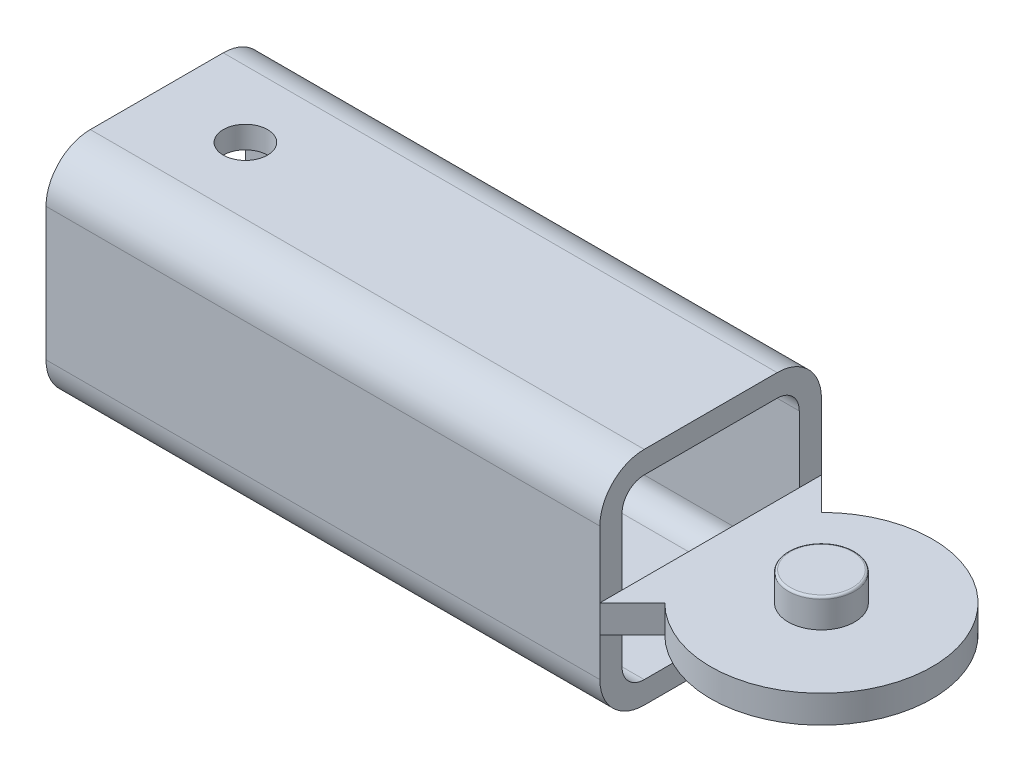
SolidWorks part; units mm, degrees
ref_plane "Front Plane" through (0, 0, 0) normal (0, 0, 1) x (1, 0, 0)
ref_plane "Top Plane" through (0, 0, 0) normal (0, 1, 0) x (1, 0, 0)
ref_plane "Right Plane" through (0, 0, 0) normal (1, 0, 0) x (0, 0, -1)
sketch "Sketch1" plane through (0, 0, 0) normal (0, 1, 0) x (1, 0, 0)
  line L0 (-27.3244, 0) -> (22.6756, 0)
  dimension "D1" = 50
other "Square tube 20 X 20 X 2(1)"
ref_plane "Plane1" through (-27.3244, 0, 0) normal (1, 0, 0) x (0, 0, -1)
sketch "Sketch11" plane through (-27.3244, 0, 0) normal (1, 0, 0) x (0, 0, -1)
  line L0 (-6, -8) -> (6, -8)
  line L1 (-8, -6) -> (-8, 6)
  line L2 (6, 8) -> (-6, 8)
  line L3 (8, 6) -> (8, -6)
  line L4 (-6, -10) -> (6, -10)
  line L5 (-10, -6) -> (-10, 6)
  line L6 (6, 10) -> (-6, 10)
  line L7 (10, 6) -> (10, -6)
  arc A0 (10, 6) -> (6, 10) centre (6, 6) ccw
  arc A1 (6, -10) -> (10, -6) centre (6, -6) ccw
  arc A2 (-10, -6) -> (-6, -10) centre (-6, -6) ccw
  arc A3 (-6, 10) -> (-10, 6) centre (-6, 6) ccw
  arc A4 (-6, 8) -> (-8, 6) centre (-6, 6) ccw
  arc A5 (8, 6) -> (6, 8) centre (6, 6) ccw
  arc A6 (6, -8) -> (8, -6) centre (6, -6) ccw
  arc A7 (-8, -6) -> (-6, -8) centre (-6, -6) ccw
  point P0 (-10, 0)
  point P1 (10, 0)
  point P2 (0, 10)
  point P3 (0, -10)
  point P4 (0, 0)
  point P5 (-10, -10)
  point P6 (10, -10)
  point P7 (10, 10)
  point P8 (-10, 10)
  point P33 (0, 0)
  dimension "D1" = 4
  dimension "Thickness" = 2
  dimension "V_leg" = 20
sketch "Sketch12" plane through (22.6756, 0, 0) normal (1, 0, 0) x (0, 0, -1)
  line L0 (10, -6) -> (10, 6) construction
  line L2 (-10, 0) -> (-10, -2.5)
  line L3 (-10, -2.5) -> (10, -2.5)
  line L4 (10, 0) -> (10, -2.5)
  line L5 (0, 0) -> (10, -2.5) construction
  line L6 (-10, -2.5) -> (0, 0) construction
  line L7 (-10, 0) -> (10, 0)
  point P0 (0, 0)
  dimension "D1" = 20
  dimension "D2" = 2.5
extrude "Boss-Extrude1" add sketch "Sketch12" along normal blind 20
sketch "Sketch15" plane through (0, 0, 0) normal (0, 1, 0) x (1, 0, 0)
  line L0 (42.6756, -10) -> (22.6756, -10) construction
  line L1 (32.6756, 10) -> (42.6756, 10)
  line L4 (42.6756, 10) -> (42.6756, 0)
  line L5 (42.6756, 0) -> (42.6756, -10)
  line L6 (39.7467, 7.0711) -> (42.6756, 10) construction
  line L7 (42.6756, -10) -> (32.6756, -10)
  arc A0 (32.6756, 10) -> (42.6756, 0) centre (32.6756, 0) cw
  arc A1 (42.6756, 0) -> (32.6756, -10) centre (32.6756, 0) cw
  point P0 (32.6756, 0)
extrude "Cut-Extrude1" cut sketch "Sketch15" against normal blind 20 contours L4 L1 A0 | A1 L7 L5
sketch "Sketch16" plane through (0, 0, 0) normal (0, 1, 0) x (1, 0, 0)
  line L0 (25.6046, 7.0711) -> (22.6756, 10)
  line L1 (22.6756, 10) -> (32.6756, 10)
  line L2 (25.6046, -7.0711) -> (22.6756, -10)
  line L3 (22.6756, -10) -> (32.6756, -10)
  arc A0 (32.6756, 10) -> (25.6046, 7.0711) centre (32.6756, 0) ccw
  arc A1 (25.6046, -7.0711) -> (32.6756, -10) centre (32.6756, 0) ccw
extrude "Cut-Extrude2" cut sketch "Sketch16" against normal blind 20
sketch "Sketch17" plane through (0, 0, 0) normal (0, 1, 0) x (1, 0, 0)
  circle A0 centre (32.6756, 0) radius 3
  dimension "D1" = 6
extrude "Boss-Extrude2" add sketch "Sketch17" along normal blind 2.6 separate body
fillet "Fillet2" radius 0.2 1 edges at (32.6756, 2.6, 3)
sketch "Sketch18" plane through (0, -2.5, 0) normal (0, -1, 0) x (1, 0, 0)
  circle A0 centre (32.6756, 0) radius 8
  circle A1 centre (32.6756, 0) radius 7
  dimension "D1" = 16
  dimension "D2" = 14
extrude "Cut-Extrude4" cut sketch "Sketch18" against normal blind 0.2
sketch "Sketch19" plane through (0, -10, 0) normal (0, -1, 0) x (1, 0, 0)
  line L0 (-27.3244, 0) -> (22.6756, 0) construction
  line L1 (-27.3244, 6) -> (-27.3244, -6) construction
  circle A0 centre (-19.3244, 0) radius 2
  dimension "D1" = 4
  dimension "D2" = 8
extrude "Cut-Extrude5" cut sketch "Sketch19" against normal blind 20
